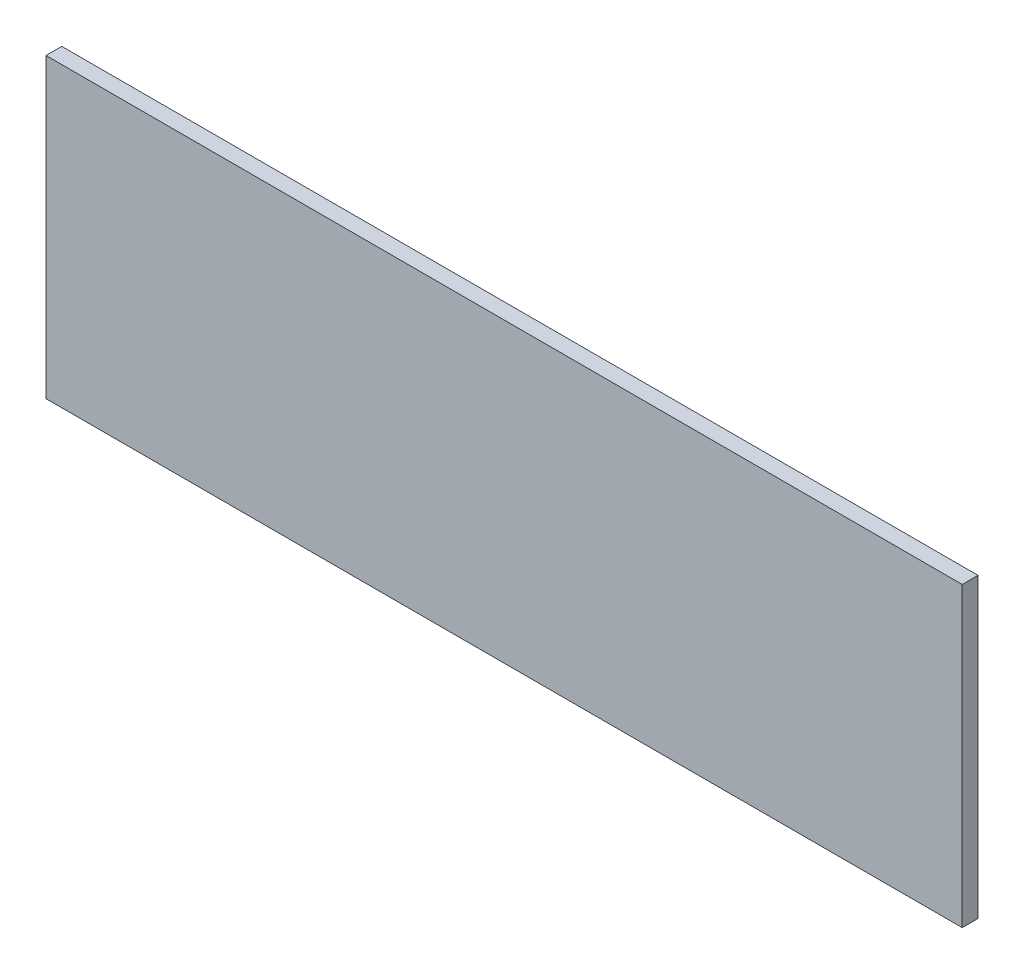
SolidWorks part; units mm, degrees
ref_plane "Plan de face" through (0, 0, 0) normal (0, 0, 1) x (1, 0, 0)
ref_plane "Plan de dessus" through (0, 0, 0) normal (0, 1, 0) x (1, 0, 0)
ref_plane "Plan de droite" through (0, 0, 0) normal (1, 0, 0) x (0, 0, -1)
sketch "Esquisse1" plane through (0, 0, 0) normal (0, 0, 1) x (1, 0, 0)
  line L0 (-115.8631, -259.2528) -> (-115.8631, -427.4028)
  line L25 (-115.8631, -249.2528) -> (484.1369, -249.2528)
  line L29 (-115.8631, -249.2528) -> (-105.8631, -249.2528)
  line L30 (-115.8631, -249.2528) -> (-115.8631, -259.2528)
  line L31 (-115.8631, -259.2528) -> (-105.8631, -259.2528)
  line L32 (-105.8631, -249.2528) -> (-105.8631, -259.2528)
  line L33 (484.1369, -437.4028) -> (474.1369, -437.4028)
  line L34 (484.1369, -437.4028) -> (484.1369, -427.4028)
  line L35 (484.1369, -427.4028) -> (474.1369, -427.4028)
  line L36 (474.1369, -437.4028) -> (474.1369, -427.4028)
  line L43 (-115.8631, -427.4028) -> (-105.8631, -427.4028)
  line L44 (-105.8631, -437.4028) -> (-105.8631, -427.4028)
  line L45 (-105.8631, -437.4028) -> (474.1369, -437.4028)
  line L46 (-105.8631, -249.2528) -> (-105.8631, -437.4028)
  line L47 (474.1369, -249.2528) -> (474.1369, -437.4028)
  dimension "D1" = 168.15
  dimension "D2" = 600
  dimension "D3" = 10
  dimension "D4" = 10
  dimension "D6" = 188.15
extrude "Boss.-Extru.1" add sketch "Esquisse1" along normal blind 10
